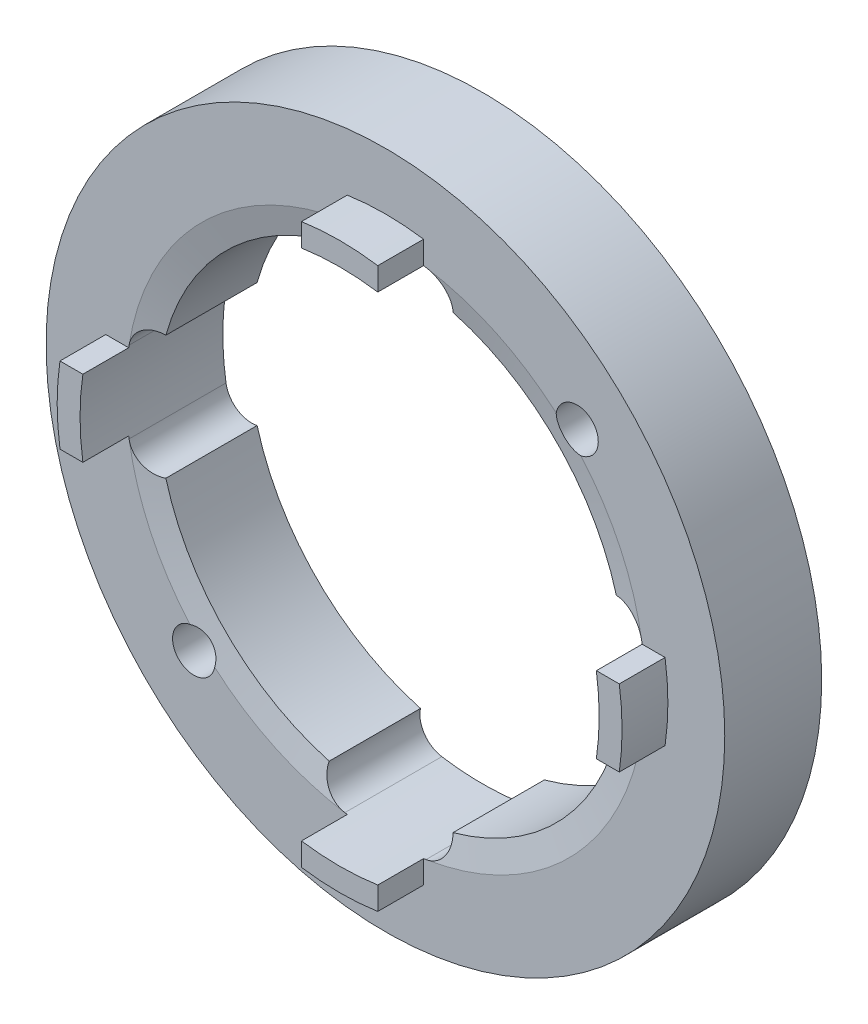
SolidWorks part; units mm, degrees
ref_plane "Front Plane" through (0, 0, 0) normal (0, 0, 1) x (1, 0, 0)
ref_plane "Top Plane" through (0, 0, 0) normal (0, 1, 0) x (1, 0, 0)
ref_plane "Right Plane" through (0, 0, 0) normal (1, 0, 0) x (0, 0, -1)
sketch "Sketch1" plane through (0, 0, 0) normal (0, 0, 1) x (1, 0, 0)
  circle A0 centre (0, 0) radius 22.225
  dimension "D1" = 44.45
extrude "Boss-Extrude1" add sketch "Sketch1" along normal blind 6.35
sketch "Sketch2" plane through (0, 0, 6.35) normal (0, 0, 1) x (1, 0, 0)
  circle A0 centre (0, 0) radius 15.3
  dimension "D1" = 30.6
extrude "Cut-Extrude1" cut sketch "Sketch2" against normal up to next
sketch "Sketch3" plane through (0, 0, 0) normal (0, 1, 0) x (1, 0, 0)
  line L0 (0, 0) -> (0, -6.35) construction
  line L1 (-15.3, -6.35) -> (15.3, -6.35) construction
  line L2 (-13.5, 0) -> (-13.5, -6.35) construction
  line L3 (22.225, 0) -> (-22.225, 0) construction
  line L4 (-22.225, -6.35) -> (22.225, -6.35) construction
  line L5 (-17, -6.35) -> (-10, -4.8184)
  line L6 (-10, -4.8184) -> (-10, -6.35)
  line L7 (-10, -6.35) -> (-17, -6.35)
  point P13 (-13.5, -5.5842)
  dimension "D1" = 10
  dimension "D2" = 77.658
  dimension "D3" = 17
revolve "Cut-Revolve1" cut sketch "Sketch3" angle 360 about L0
sketch "Sketch4" plane through (0, 0, 6.35) normal (0, 0, 1) x (1, 0, 0)
  line L0 (0, 0) -> (-50000, 0) construction
  line L1 (-18.3152, 2.5) -> (-16.8152, 2.5)
  line L2 (-18.3152, -2.5) -> (-16.8152, -2.5)
  arc A0 (-16.8152, 2.5) -> (-16.8152, -2.5) centre (0, 0) ccw
  arc A1 (-18.3152, 2.5) -> (-18.3152, -2.5) centre (-1.5, 0) ccw
  dimension "D1" = 5
  dimension "D2" = 17
  dimension "D3" = 1.5
extrude "Boss-Extrude2" add sketch "Sketch4" along normal blind 3 and the other way up to next (6.35 mm away)
sketch "Sketch5" plane through (0, 0, 6.35) normal (0, 0, 1) x (1, 0, 0)
  line L0 (0, 0) -> (-50000, 0) construction
  line L1 (0, 0) -> (-15.1116, -2.3934) construction
  line L2 (0, 0) -> (-15.1116, 2.3934) construction
  circle A0 centre (0, 0) radius 15.3 construction
  arc A3 (-15.1116, -2.3934) -> (-15.1116, 2.3934) centre (0, 0) cw construction
  arc A4 (-16.7907, 2.6594) -> (-16.7907, -2.6594) centre (0, 0) ccw
  arc A5 (-13.4326, 2.1275) -> (-13.4326, -2.1275) centre (0, 0) ccw
  arc A6 (-13.4326, 2.1275) -> (-16.7907, 2.6594) centre (-15.1116, 2.3934) ccw
  arc A7 (-16.7907, -2.6594) -> (-13.4326, -2.1275) centre (-15.1116, -2.3934) ccw
  arc A8 (-16.8152, 2.5) -> (-16.8152, -2.5) centre (0, 0) ccw construction
  point P10 (-15.3, 0)
  dimension "D1" = 18
extrude "Cut-Extrude2" cut sketch "Sketch5" against normal through all
pattern_circular "CirPattern1" count 4 over 360 about axis through (0, 0, 0) along (0, 0, 1) of "Cut-Extrude2", "Boss-Extrude2"
hole_wizard "7/64 (0.10938) Diameter Hole1" positions "Sketch7" profile "Sketch6" hole size "7/64" standard "ANSI Inch"
sketch "Sketch7" plane through (0, 0, 0) normal (0, 0, -1) x (-1, 0, 0)
  line L0 (-12.5511, 12.5511) -> (12.5511, -12.5511) construction
  line L3 (0, 0) -> (10.0384, 0) construction
  point P0 (12.5511, -12.5511)
  point P2 (-12.5511, 12.5511)
  dimension "D1" = 135
  dimension "D2" = 35.5
sketch "Sketch6" plane through (-12.5511, -12.5511, 0) normal (1, 0, 0) x (0, 1, 0)
  line L0 (0, 0) -> (0, 9.35)
  line L1 (0, 9.35) -> (1.3891, 9.35)
  line L2 (1.3891, 9.35) -> (1.3891, 0)
  line L5 (1.3891, 0) -> (0, 0)
  line L11 (0, -6.35) -> (0, 107.95) construction
  dimension "Thru Hole Dia." = 2.7783
  dimension "Thru Hole Depth" = 9.35
